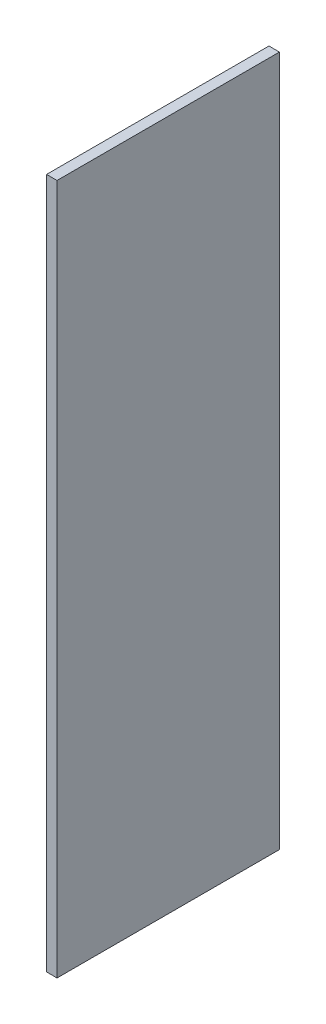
SolidWorks part; units mm, degrees
ref_plane "Front Plane" through (0, 0, 0) normal (0, 0, 1) x (1, 0, 0)
ref_plane "Top Plane" through (0, 0, 0) normal (0, 1, 0) x (1, 0, 0)
ref_plane "Right Plane" through (0, 0, 0) normal (1, 0, 0) x (0, 0, -1)
sketch "Sketch1" plane through (0, 0, 0) normal (1, 0, 0) x (0, 0, -1)
  line L1 (-71.3589, 158.6222) -> (63.5786, 158.6222)
  line L2 (-71.3589, 158.6222) -> (-71.3589, -260.4778)
  line L3 (-71.3589, -260.4778) -> (63.5786, -260.4778)
  line L4 (63.5786, 158.6222) -> (63.5786, -260.4778)
  dimension "D1" = 419.1
  dimension "D2" = 134.9375
extrude "Boss-Extrude1" add sketch "Sketch1" along normal blind 6.35
